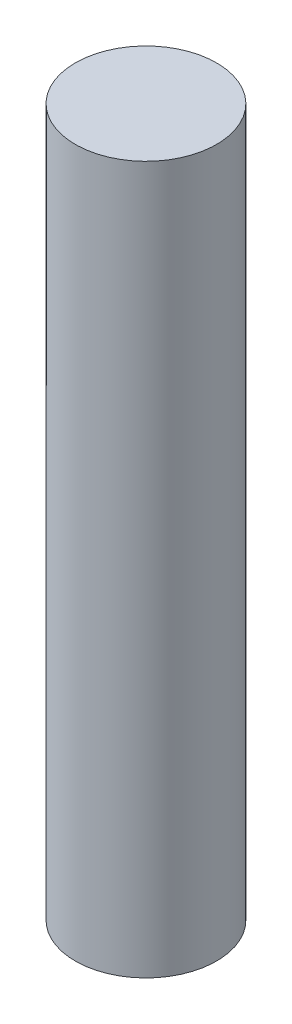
SolidWorks part; units mm, degrees
ref_plane "Plan de face" through (0, 0, 0) normal (0, 0, 1) x (1, 0, 0)
ref_plane "Plan de dessus" through (0, 0, 0) normal (0, 1, 0) x (1, 0, 0)
ref_plane "Plan de droite" through (0, 0, 0) normal (1, 0, 0) x (0, 0, -1)
sketch "Esquisse1" plane through (0, 0, 0) normal (0, 0, 1) x (1, 0, 0)
  line L1 (-41.8427, 35.1774) -> (-39.5737, 35.1774)
  line L2 (-41.8427, 35.1774) -> (-41.8427, 12.4674)
  line L3 (-41.8427, 12.4674) -> (-39.5737, 12.4674)
  line L4 (-39.5737, 35.1774) -> (-39.5737, 12.4674)
  dimension "D1" = 2.269
  dimension "D2" = 22.71
revolve "Révolution1" add sketch "Esquisse1" angle 360 about L2
